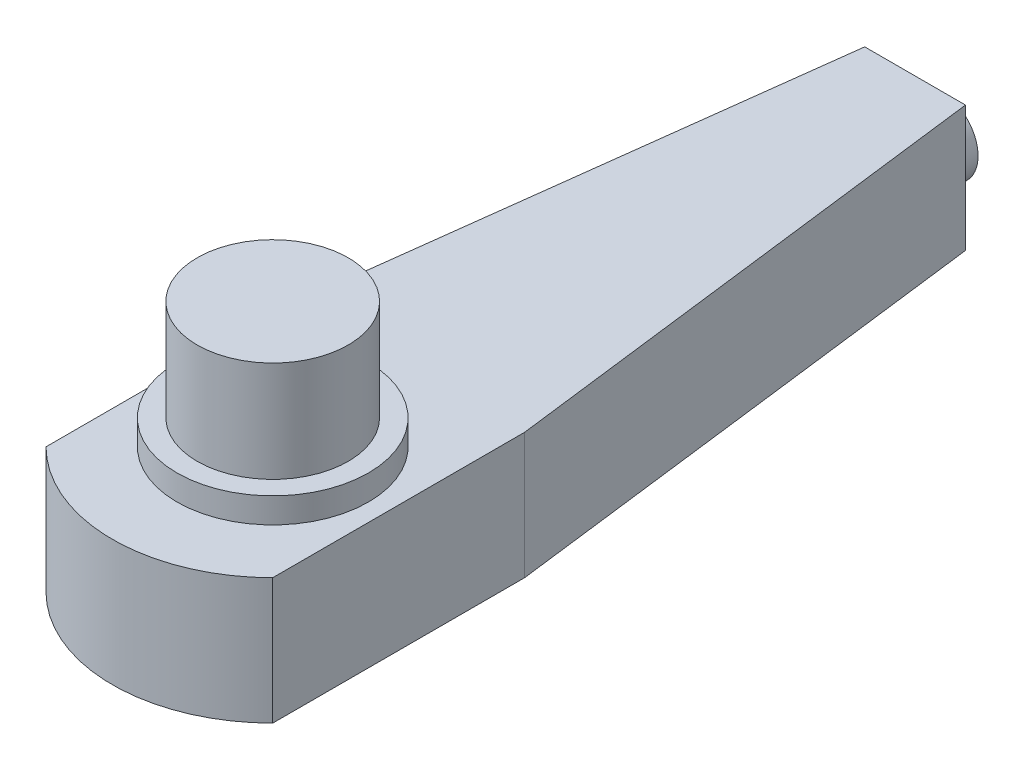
SolidWorks part; units mm, degrees
ref_plane "Alzado" through (0, 0, 0) normal (0, 0, 1) x (1, 0, 0)
ref_plane "Planta" through (0, 0, 0) normal (0, 1, 0) x (1, 0, 0)
ref_plane "Vista lateral" through (0, 0, 0) normal (1, 0, 0) x (0, 0, -1)
sketch "Croquis1" plane through (0, 0, 0) normal (0, 1, 0) x (1, 0, 0)
  line L0 (-22.5, -75) -> (-22.5, -25)
  line L5 (-22.5, -25) -> (-10, 75)
  line L6 (22.5, -25) -> (10, 75)
  line L7 (22.5, -75) -> (22.5, -25)
  line L8 (0, -86.2925) -> (0, 75) construction
  line L9 (-68.6893, 75) -> (68.6893, 75) construction
  line L10 (10, 75) -> (-10, 75)
  arc A0 (22.5, -75) -> (-22.5, -75) centre (0, -52.5) cw
  point P0 (0, 0)
  point P14 (0, 75)
  dimension "D1" = 45
  dimension "D2" = 10
  dimension "D3" = 50
  dimension "D4" = 50
  dimension "D5" = 10
  dimension "D6" = 100
  dimension "D7" = 100
extrude "Saliente-Extruir1" add sketch "Croquis1" along normal blind 25
sketch "Croquis2" plane through (0, 25, 0) normal (0, 1, 0) x (1, 0, 0)
  circle A0 centre (0, -52.5) radius 19
  dimension "D1" = 38
extrude "Saliente-Extruir2" add sketch "Croquis2" along normal blind 5
sketch "Croquis3" plane through (0, 30, 0) normal (0, 1, 0) x (1, 0, 0)
  circle A0 centre (0, -52.5) radius 15
  dimension "D1" = 30
extrude "Saliente-Extruir3" add sketch "Croquis3" along normal blind 20
sketch "Croquis4" plane through (0, 0, -75) normal (0, 0, -1) x (-1, 0, 0)
  circle A0 centre (0, 12.5) radius 7.5
  dimension "D1" = 15
extrude "Saliente-Extruir4" add sketch "Croquis4" along normal blind 5
